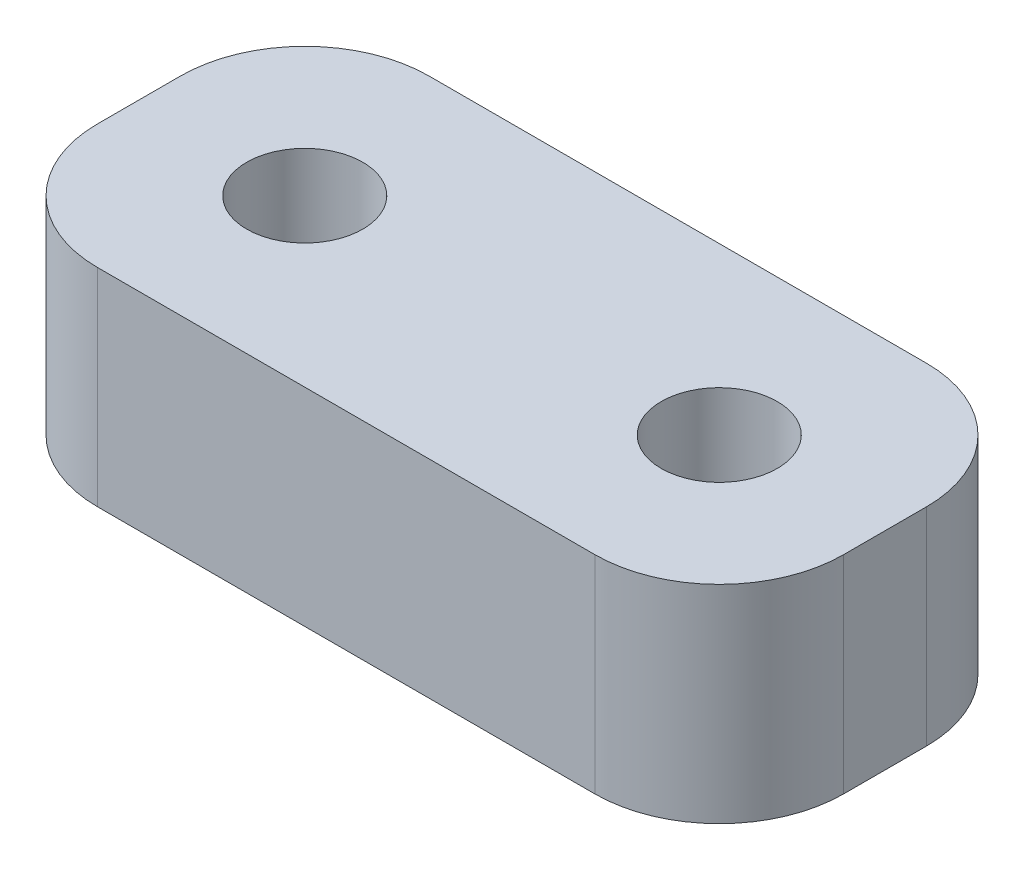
SolidWorks part; units mm, degrees
ref_plane "Front Plane" through (0, 0, 0) normal (0, 0, 1) x (1, 0, 0)
ref_plane "Top Plane" through (0, 0, 0) normal (0, 1, 0) x (1, 0, 0)
ref_plane "Right Plane" through (0, 0, 0) normal (1, 0, 0) x (0, 0, -1)
sketch "Sketch1" plane through (0, 0, 0) normal (0, 1, 0) x (1, 0, 0)
  line L0 (0, 9.7865) -> (0, -14.0594) construction
  line L1 (-9, 2.2477) -> (9, 2.2477)
  line L2 (-9, 2.2477) -> (-9, -5.7523)
  line L3 (-9, -5.7523) -> (9, -5.7523)
  line L4 (9, 2.2477) -> (9, -5.7523)
  line L5 (-11.3778, -1.7523) -> (16.0871, -1.7523) construction
  circle A0 centre (-5, -1.7523) radius 1.4
  circle A1 centre (5, -1.7523) radius 1.4
  dimension "D1" = 2.8
  dimension "D2" = 2.8
  dimension "D3" = 5
  dimension "D4" = 5
  dimension "D5" = 18
  dimension "D6" = 9
  dimension "D7" = 8
  dimension "D8" = 4
extrude "Boss-Extrude1" add sketch "Sketch1" along normal blind 5
fillet "Fillet1" radius 3 4 edges at (9, 2.5, 5.7523) (9, 2.5, -2.2477) (-9, 2.5, 5.7523) (-9, 2.5, -2.2477)
